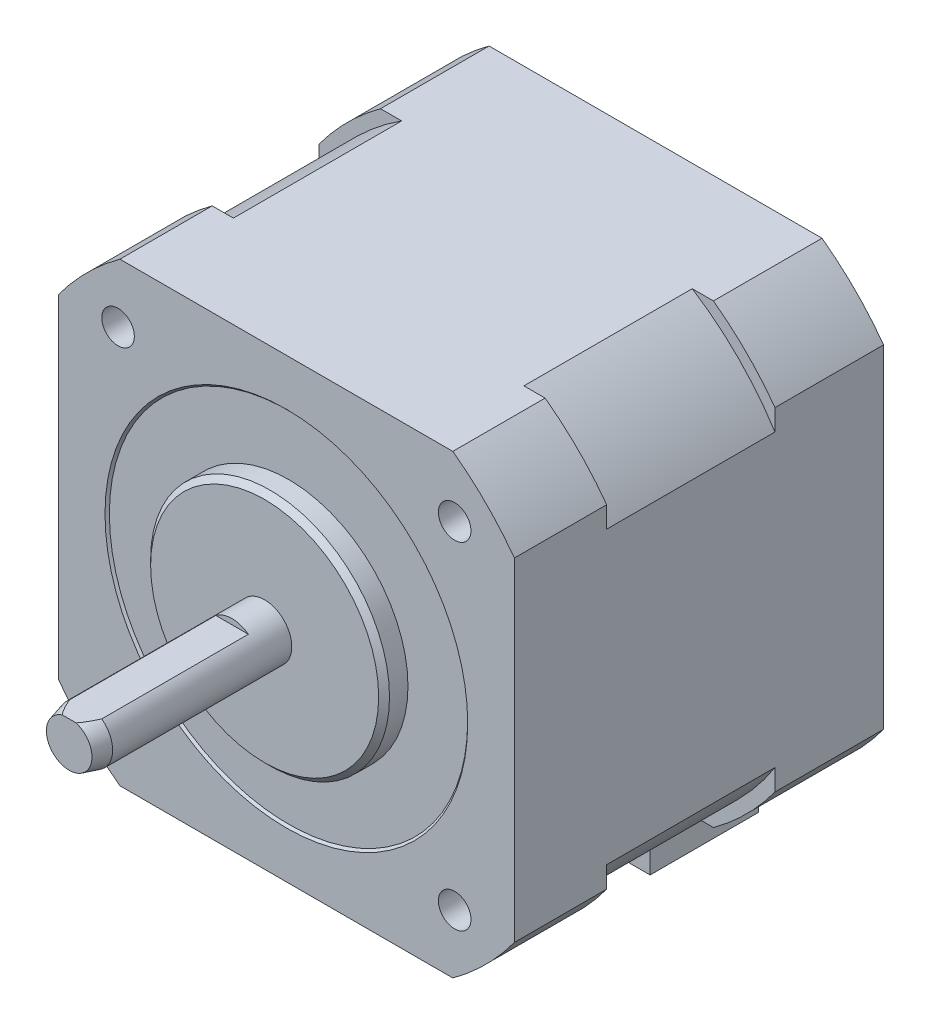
SolidWorks part; units mm, degrees
ref_plane "正面" through (0, 0, 0) normal (0, 0, 1) x (1, 0, 0)
ref_plane "平面" through (0, 0, 0) normal (0, 1, 0) x (1, 0, 0)
ref_plane "右側面" through (0, 0, 0) normal (1, 0, 0) x (0, 0, -1)
sketch "ｽｹｯﾁ1" plane through (0, 0, 0) normal (0, 0, 1) x (1, 0, 0)
  circle A0 centre (0, 0) radius 2.5
  dimension "D1" = 5
extrude "押し出し1" add sketch "ｽｹｯﾁ1" along normal blind 18
sketch "ｽｹｯﾁ2" plane through (0, 0, 0) normal (0, 0, -1) x (-1, 0, 0)
  circle A0 centre (0, 0) radius 11
  dimension "D1" = 22
extrude "押し出し2" add sketch "ｽｹｯﾁ2" along normal blind 2
sketch "ｽｹｯﾁ3" plane through (0, 0, -2) normal (0, 0, -1) x (-1, 0, 0)
  line L1 (-21, 21) -> (21, 21)
  line L2 (-21, 21) -> (-21, -21)
  line L3 (-21, -21) -> (21, -21)
  line L4 (21, 21) -> (21, -21)
  line L5 (-21, 21) -> (21, -21) construction
  line L6 (-21, -21) -> (21, 21) construction
  point P0 (0, 0)
  point P6 (0, 0)
  dimension "D1" = 42
  dimension "D2" = 42
extrude "押し出し3" add sketch "ｽｹｯﾁ3" along normal blind 8.5
sketch "Sketch8" plane through (0, 0, -2) normal (0, 0, 1) x (1, 0, 0)
  circle A0 centre (0, 0) radius 26
  dimension "D1" = 52
extrude "Extrude8" cut sketch "Sketch8" against normal blind 34 flip side to cut
sketch "Sketch9" plane through (0, 0, -10.5) normal (0, 0, -1) x (-1, 0, 0)
  line L4 (-21, 15.3297) -> (-21, -15.3297) construction
  line L5 (-15.3297, -21) -> (15.3297, -21) construction
  line L6 (21, -15.3297) -> (21, 15.3297) construction
  line L7 (15.3297, 21) -> (-15.3297, 21) construction
  line L8 (-21, 13.3795) -> (-21, -13.3795)
  line L9 (-13.3795, -21) -> (13.3795, -21)
  line L10 (21, -13.3795) -> (21, 13.3795)
  line L11 (13.3795, 21) -> (-13.3795, 21)
  arc A1 (21, 13.3795) -> (13.3795, 21) centre (0, 0) ccw
  arc A2 (-13.3795, 21) -> (-21, 13.3795) centre (0, 0) ccw
  arc A3 (-21, -13.3795) -> (-13.3795, -21) centre (0, 0) ccw
  arc A4 (13.3795, -21) -> (21, -13.3795) centre (0, 0) ccw
  dimension "D1" = 49.8
extrude "Extrude9" add sketch "Sketch9" along normal blind 15.5
sketch "Sketch14" plane through (0, 0, -2) normal (0, 0, 1) x (1, 0, 0)
  line L5 (15.5, -15.5) -> (-15.5, 15.5) construction
  line L6 (15.5, 15.5) -> (-15.5, -15.5) construction
  circle A0 centre (-15.5, 15.5) radius 1.5
  circle A1 centre (15.5, 15.5) radius 1.5
  circle A2 centre (15.5, -15.5) radius 1.5
  circle A3 centre (-15.5, -15.5) radius 1.5
  point P0 (0, 0)
  dimension "D3" = 3
  dimension "D4" = 3
  dimension "D5" = 3
  dimension "D6" = 3
  dimension "D1" = 31
  dimension "D2" = 31
  dimension "D7" = 15.5
  dimension "D8" = 15.5
  dimension "D9" = 31
  dimension "D10" = 31
extrude "Extrude13" cut sketch "Sketch14" against normal blind 4.5
sketch "Sketch11" plane through (0, 0, -26) normal (0, 0, -1) x (-1, 0, 0)
  line L0 (-21, 13.3795) -> (-21, -13.3795) construction
  line L1 (-21, 15.3297) -> (-21, 13.3795) construction
  line L2 (-21, -13.3795) -> (-21, -15.3297) construction
  line L3 (-13.3795, -21) -> (13.3795, -21) construction
  line L4 (-15.3297, -21) -> (-13.3795, -21) construction
  line L5 (13.3795, -21) -> (15.3297, -21) construction
  line L6 (21, -15.3297) -> (21, -13.3795) construction
  line L7 (21, -13.3795) -> (21, 13.3795) construction
  line L8 (21, 13.3795) -> (21, 15.3297) construction
  line L9 (15.3297, 21) -> (13.3795, 21) construction
  line L10 (-13.3795, 21) -> (-15.3297, 21) construction
  line L11 (-21, 13.3795) -> (-21, -13.3795)
  line L12 (-21, 15.3297) -> (-21, 13.3795)
  line L13 (-21, -13.3795) -> (-21, -15.3297)
  line L14 (-13.3795, -21) -> (13.3795, -21)
  line L15 (-15.3297, -21) -> (-13.3795, -21)
  line L16 (13.3795, -21) -> (15.3297, -21)
  line L17 (21, -15.3297) -> (21, -13.3795)
  line L18 (21, -13.3795) -> (21, 13.3795)
  line L19 (21, 13.3795) -> (21, 15.3297)
  line L20 (15.3297, 21) -> (13.3795, 21)
  line L21 (-13.3795, 21) -> (-15.3297, 21)
  line L22 (13.3795, 21) -> (-13.3795, 21) construction
  line L23 (13.3795, 21) -> (-13.3795, 21)
  arc A0 (-15.3297, 21) -> (-21, 15.3297) centre (0, 0) ccw construction
  arc A1 (-21, -15.3297) -> (-15.3297, -21) centre (0, 0) ccw construction
  arc A2 (15.3297, -21) -> (21, -15.3297) centre (0, 0) ccw construction
  arc A3 (21, 15.3297) -> (15.3297, 21) centre (0, 0) ccw construction
  arc A4 (-15.3297, 21) -> (-21, 15.3297) centre (0, 0) ccw
  arc A5 (-21, -15.3297) -> (-15.3297, -21) centre (0, 0) ccw
  arc A6 (15.3297, -21) -> (21, -15.3297) centre (0, 0) ccw
  arc A7 (21, 15.3297) -> (15.3297, 21) centre (0, 0) ccw
extrude "Extrude11" add sketch "Sketch11" along normal blind 10
chamfer "Chamfer5" distance 1.5 angle 15 1 edges at (2.5, 0, 18)
sketch "Sketch2" plane through (0, 0, 18) normal (0, 0, 1) x (1, 0, 0)
  line L1 (-4.7278, 5.1185) -> (3.4221, 5.1185)
  line L2 (-4.7278, 5.1185) -> (-4.7278, 2)
  line L3 (-4.7278, 2) -> (3.4221, 2)
  line L4 (3.4221, 5.1185) -> (3.4221, 2)
  dimension "D1" = 2
extrude "Extrude2" cut sketch "Sketch2" against normal blind 15
sketch "Sketch6" plane through (0, 0, -2) normal (0, 0, 1) x (1, 0, 0)
  circle A0 centre (0, 0) radius 16.5
  circle A1 centre (0, 0) radius 11 construction
  circle A2 centre (0, 0) radius 11
  dimension "D2" = 33
extrude "Extrude6" cut sketch "Sketch6" against normal blind 0.2
chamfer "Chamfer2" distance 0.5 angle 45 1 edges at (-11, 0, 0)
chamfer "Chamfer7" distance 0.2 angle 45 1 edges at (16.5, 0, -2)
sketch "Sketch13" plane through (0, -21, 0) normal (0, -1, 0) x (1, 0, 0)
  line L0 (15.3297, -36) -> (-15.3297, -36) construction
  line L1 (-9.5, -26) -> (9.5, -26)
  line L2 (-9.5, -26) -> (-9.5, -36)
  line L3 (-9.5, -36) -> (9.5, -36)
  line L4 (9.5, -26) -> (9.5, -36)
  line L5 (-21, -36) -> (-21, -26) construction
  dimension "D1" = 10
  dimension "11.5" = 11.5
  dimension "D2" = 19
extrude "Extrude12" add sketch "Sketch13" along normal blind 6.7
